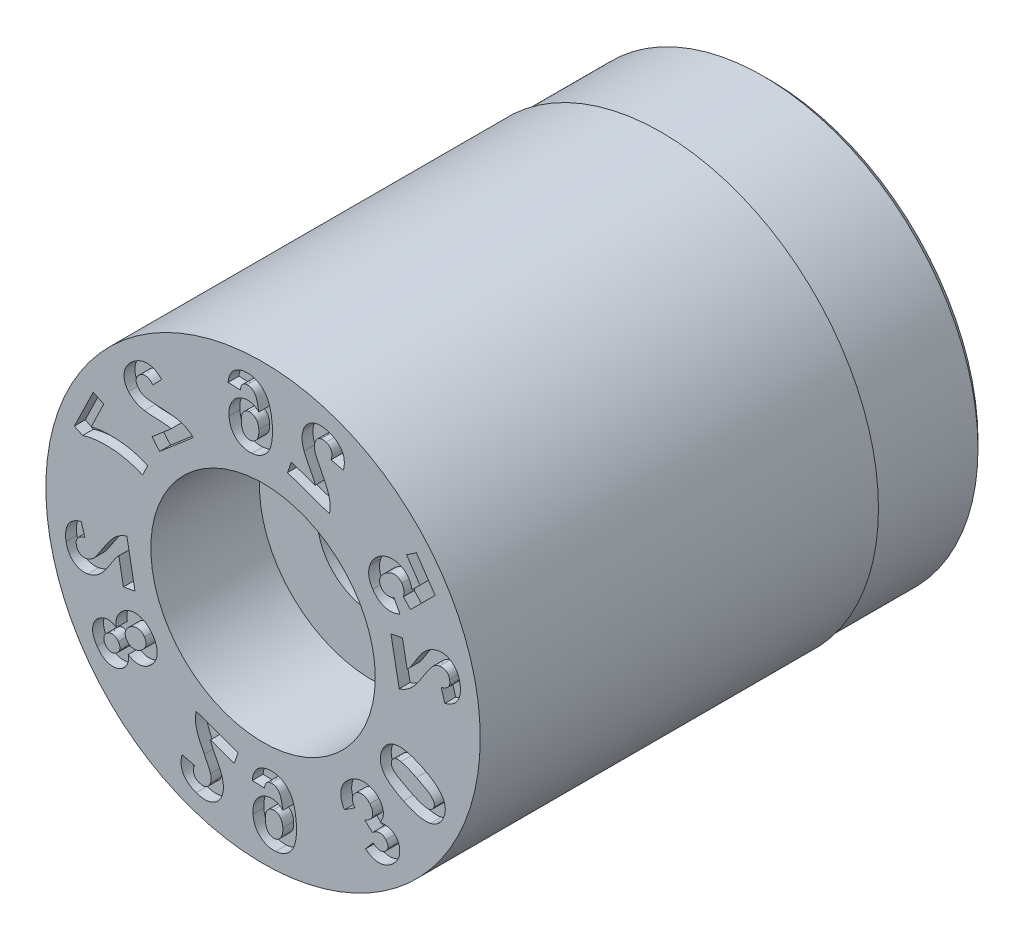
SolidWorks part; units mm, degrees
ref_plane "Front Plane" through (0, 0, 0) normal (0, 0, 1) x (1, 0, 0)
ref_plane "Top Plane" through (0, 0, 0) normal (0, 1, 0) x (1, 0, 0)
ref_plane "Right Plane" through (0, 0, 0) normal (1, 0, 0) x (0, 0, -1)
sketch "Sketch1" plane through (0, 0, 0) normal (1, 0, 0) x (0, 0, -1)
  line L2 (0, 6) -> (0, 3.1)
  line L3 (13.75, 6) -> (0, 6)
  line L4 (-3.7979, 0) -> (49996.2021, 0) construction
  line L8 (14, 1.5) -> (3, 1.5)
  line L9 (3, 3.1) -> (3, 1.5)
  line L10 (3, 3.1) -> (0, 3.1)
  line L12 (14, 1.5) -> (14, 5.75)
  line L16 (14, 5.75) -> (13.75, 6)
  dimension "D1" = 14
  dimension "D2" = 45
  dimension "D3" = 0.25
  dimension "D4" = 12
  dimension "D5" = 6.2
  dimension "D6" = 3
  dimension "D7" = 3
revolve "Revolve1" add sketch "Sketch1" angle 360 about L4
sketch "Sketch4" plane through (0, 0, 0) normal (1, 0, 0) x (0, 0, -1)
  line L0 (0, 0) -> (50000, 0) construction
  line L1 (14, -5.75) -> (14, 5.75) construction
  line L2 (11, 6.935) -> (14, 6.935)
  line L3 (11, 6.935) -> (11, 5.935)
  line L4 (11, 5.935) -> (14, 5.935)
  line L5 (14, 6.935) -> (14, 5.935)
  line L6 (13.75, 6) -> (0, 6) construction
  line L9 (0, 6.6) -> (0, -6.6) construction
  dimension "D1" = 1
  dimension "D2" = 0.065
  dimension "D3" = 11
revolve "Cut-Revolve1" cut sketch "Sketch4" angle 360 about L0
sketch "Sketch5" plane through (0, 0, 0) normal (0, 0, 1) x (1, 0, 0)
  circle A0 centre (0, 0) radius 3.7731 construction
  text T0 "25 26 27 28 29 30" font "Arial" height 1.84
  dimension "D1" = 7.5461
extrude "Cut-Extrude1" cut sketch "Sketch5" against normal blind 0.3
